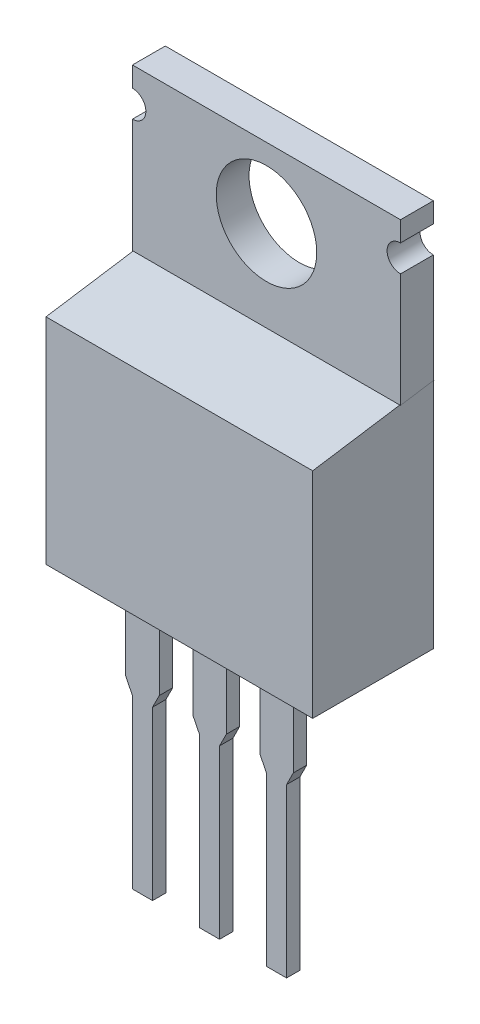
SolidWorks part; units mm, degrees
ref_plane "x/y" through (0, 0, 0) normal (0, 0, 1) x (1, 0, 0)
ref_plane "x/z" through (0, 0, 0) normal (0, 1, 0) x (1, 0, 0)
ref_plane "y/z" through (0, 0, 0) normal (1, 0, 0) x (0, 0, -1)
ref_plane "Plane2" through (0, 0, 1.397) normal (0, 0, 1) x (1, 0, 0)
ref_plane "Plane3" through (0, 3.81, 0) normal (0, 1, 0) x (-1, 0, 0)
ref_plane "Plane4" through (2.54, 0, 0) normal (1, 0, 0) x (0, 0, -1)
sketch "Sketch2" plane through (0, 3.81, 0) normal (0, 1, 0) x (-1, 0, 0)
  line L1 (2.54, -3.175) -> (-7.62, -3.175)
  line L2 (2.54, -3.175) -> (2.54, 1.397)
  line L3 (2.54, 1.397) -> (-7.62, 1.397)
  line L4 (-7.62, -3.175) -> (-7.62, 1.397)
  dimension "D1" = 10.16
  dimension "D2" = 4.572
  dimension "D3" = 7.62
  dimension "D4" = 3.175
extrude "Base-Extrude" add sketch "Sketch2" along normal blind 14.732
sketch "Sketch3" plane through (-2.54, 0, 0) normal (-1, 0, 0) x (0, 0, 1)
  line L0 (-1.905, 12.446) -> (-1.905, 18.542)
  line L1 (-1.905, 12.446) -> (1.397, 11.938)
  line L2 (-3.175, 18.542) -> (-3.175, 3.81) construction
  line L3 (-3.175, 18.542) -> (1.397, 18.542) construction
  line L5 (1.397, 18.542) -> (1.397, 3.81) construction
  dimension "D1" = 1.27
  dimension "D2" = 6.096
  dimension "D3" = 6.604
extrude "Cut-Extrude1" cut sketch "Sketch3" against normal through all and the other way through all
sketch "Sketch4" plane through (0, 0, -1.905) normal (0, 0, 1) x (1, 0, 0)
  line L0 (2.54, -50) -> (2.54, 50) construction
  line L1 (-2.54, 18.542) -> (7.62, 18.542) construction
  circle A0 centre (2.54, 15.875) radius 1.905
  dimension "D1" = 3.81
  dimension "D2" = 2.667
extrude "Cut-Extrude2" cut sketch "Sketch4" against normal blind 14.732
sketch "Sketch5" plane through (-2.54, 0, 0) normal (-1, 0, 0) x (0, 0, 1)
  line L0 (-1.905, 12.446) -> (1.397, 11.938) construction
  line L1 (-3.175, 18.542) -> (-3.175, 3.81) construction
  line L2 (-3.175, 3.81) -> (1.397, 3.81) construction
  line L3 (1.397, 11.938) -> (1.397, 3.81) construction
  line L4 (-3.175, 12.6414) -> (1.397, 11.938)
  line L5 (-3.175, 12.6414) -> (-3.175, 3.81)
  line L6 (-3.175, 3.81) -> (1.397, 3.81)
  line L7 (1.397, 11.938) -> (1.397, 3.81)
extrude "Cut-Extrude4" cut sketch "Sketch5" against normal blind 0.0254
sketch "Sketch6" plane through (7.62, 0, 0) normal (1, 0, 0) x (0, 0, -1)
  line L0 (-1.397, 11.938) -> (1.905, 12.446) construction
  line L1 (-1.397, 11.938) -> (-1.397, 3.81) construction
  line L2 (-1.397, 3.81) -> (3.175, 3.81) construction
  line L3 (3.175, 18.542) -> (3.175, 3.81) construction
  line L4 (-1.397, 11.938) -> (3.175, 12.6414)
  line L5 (-1.397, 11.938) -> (-1.397, 3.81)
  line L6 (-1.397, 3.81) -> (3.175, 3.81)
  line L7 (3.175, 12.6414) -> (3.175, 3.81)
extrude "Cut-Extrude5" cut sketch "Sketch6" against normal blind 0.0254
sketch "Sketch7" plane through (0, 0, -3.175) normal (0, 0, -1) x (-1, 0, 0)
  line L0 (-7.62, 18.542) -> (-7.62, 12.6414) construction
  line L1 (-7.62, 18.542) -> (2.54, 18.542) construction
  line L2 (2.54, 18.542) -> (2.54, 12.6414) construction
  line L3 (-7.62, 18.542) -> (-7.62, 12.6414)
  line L4 (-7.62, 18.542) -> (2.54, 18.542)
  line L5 (2.54, 18.542) -> (2.54, 12.6414)
  line L6 (-7.62, 12.6414) -> (-6.35, 12.6414)
  line L7 (-6.35, 12.6414) -> (-6.35, 7.112)
  line L8 (-6.35, 7.112) -> (1.27, 7.112)
  line L9 (1.27, 12.6414) -> (1.27, 7.112)
  line L10 (1.27, 12.6414) -> (2.54, 12.6414)
  line L11 (-7.5946, 3.81) -> (-7.5946, 12.6414) construction
  line L12 (-7.5946, 3.81) -> (2.5146, 3.81) construction
  line L13 (2.5146, 12.6414) -> (2.5146, 3.81) construction
  dimension "D1" = 1.2446
  dimension "D2" = 3.302
  dimension "D3" = 1.2446
extrude "Cut-Extrude6" cut sketch "Sketch7" against normal blind 0.0254
sketch "Sketch8" plane through (0, 0, -1.905) normal (0, 0, 1) x (1, 0, 0)
  line L0 (2.54, 15.8674) -> (2.54, 22.0486) construction
  line L1 (2.54, -50) -> (2.54, 50) construction
  line L2 (7.62, 12.446) -> (7.62, 18.542) construction
  line L3 (7.62, 16.764) -> (7.62, 17.78)
  line L4 (-2.54, 16.764) -> (-2.54, 17.78)
  line L5 (-2.54, 18.542) -> (-2.54, 12.446) construction
  line L6 (-2.54, 17.272) -> (9.7512, 17.272) construction
  line L7 (-2.54, 18.542) -> (7.62, 18.542) construction
  arc A0 (7.62, 17.78) -> (7.62, 16.764) centre (7.62, 17.272) ccw
  arc A1 (-2.54, 16.764) -> (-2.54, 17.78) centre (-2.54, 17.272) ccw
  dimension "D1" = 1.016
  dimension "D2" = 1.27
extrude "Cut-Extrude7" cut sketch "Sketch8" against normal blind 2.54
sketch "Sketch9" plane through (0, 0, 0) normal (0, 0, 1) x (1, 0, 0)
  line L0 (0, 3.81) -> (0, -6.35)
  line L1 (50, 3.81) -> (-50, 3.81) construction
  dimension "D1" = 10.16
extrude "Boss-Extrude-Thin1" add sketch "Sketch9" along normal mid plane 0.508 thin
ref_plane "Plane5" through (0.635, -6.35, 0.254) normal (0, -1, 0) x (1, 0, 0)
sketch "Sketch11" plane through (0, 0, 0.254) normal (0, 0, 1) x (1, 0, 0)
  line L0 (0.635, 0.508) -> (0.635, -6.35)
  line L1 (0.635, 3.81) -> (0.635, -6.35) construction
  line L2 (-0.635, 0.508) -> (-0.635, -6.35)
  line L3 (-0.635, 3.81) -> (-0.635, -6.35) construction
  line L4 (-0.381, 0) -> (-0.381, -6.35)
  line L5 (0.381, 0) -> (0.381, -6.35)
  line L6 (-49.365, -6.35) -> (50.635, -6.35) construction
  line L7 (-0.635, -6.35) -> (-0.381, -6.35)
  line L8 (0.381, -6.35) -> (0.635, -6.35)
  line L9 (0.381, 0) -> (0.635, 0.508)
  line L10 (-0.381, 0) -> (-0.635, 0.508)
  dimension "D1" = 0.762
  dimension "D2" = 0.254
extrude "Cut-Extrude8" cut sketch "Sketch11" against normal blind 1.27
pattern_linear "LPattern1" count 3 spacing 2.54 along (1, 0, 0) of "Boss-Extrude-Thin1", "Cut-Extrude8"
sketch "Mounting_Plane" plane through (0, 0, 0) normal (0, 1, 0) x (1, 0, 0)
  circle A0 centre (0, 0) radius 0.4572
  circle A1 centre (2.54, 0) radius 0.4572
  circle A2 centre (5.08, 0) radius 0.4572
